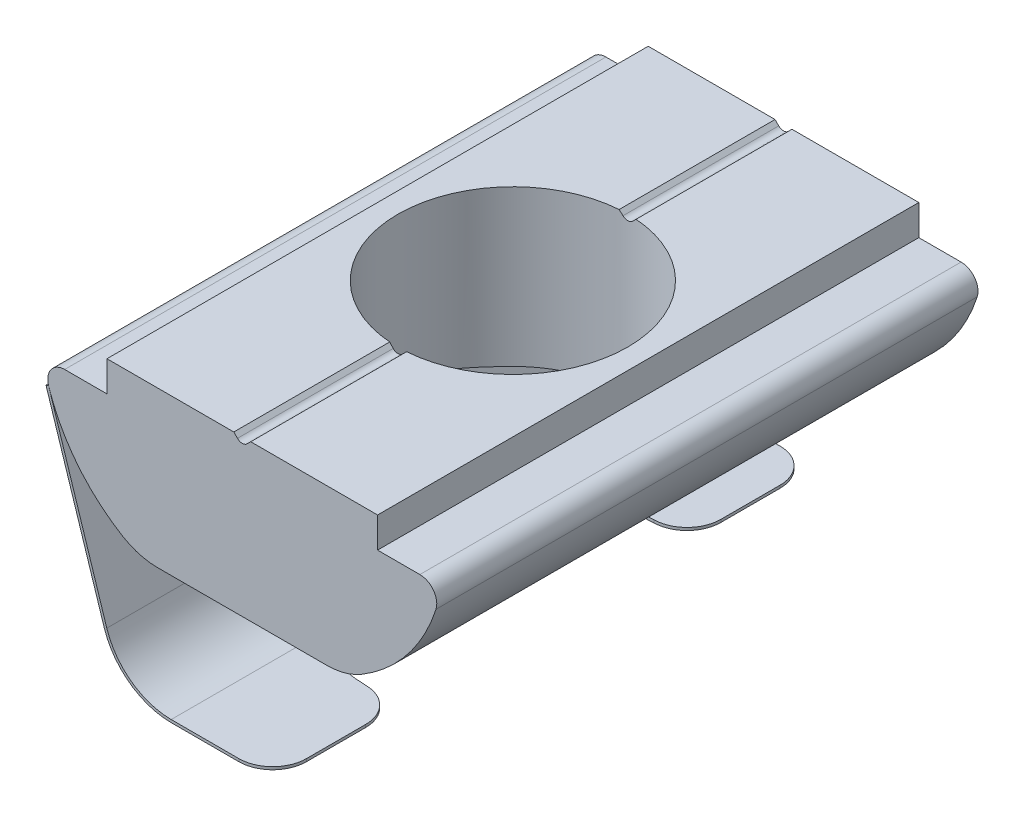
SolidWorks part; units mm, degrees
ref_plane "Front Plane" through (0, 0, 0) normal (0, 0, 1) x (1, 0, 0)
ref_plane "Top Plane" through (0, 0, 0) normal (0, 1, 0) x (1, 0, 0)
ref_plane "Right Plane" through (0, 0, 0) normal (1, 0, 0) x (0, 0, -1)
imported_body "Imported5"
imported_body "Imported6"
sketch "Sketch1" plane through (0, 0, 0) normal (0, 1, 0) x (1, 0, 0)
  circle A0 centre (0, 0) radius 3.4
  dimension "D1" = 6.8
extrude "Extrude1" cut sketch "Sketch1" against normal blind 10
